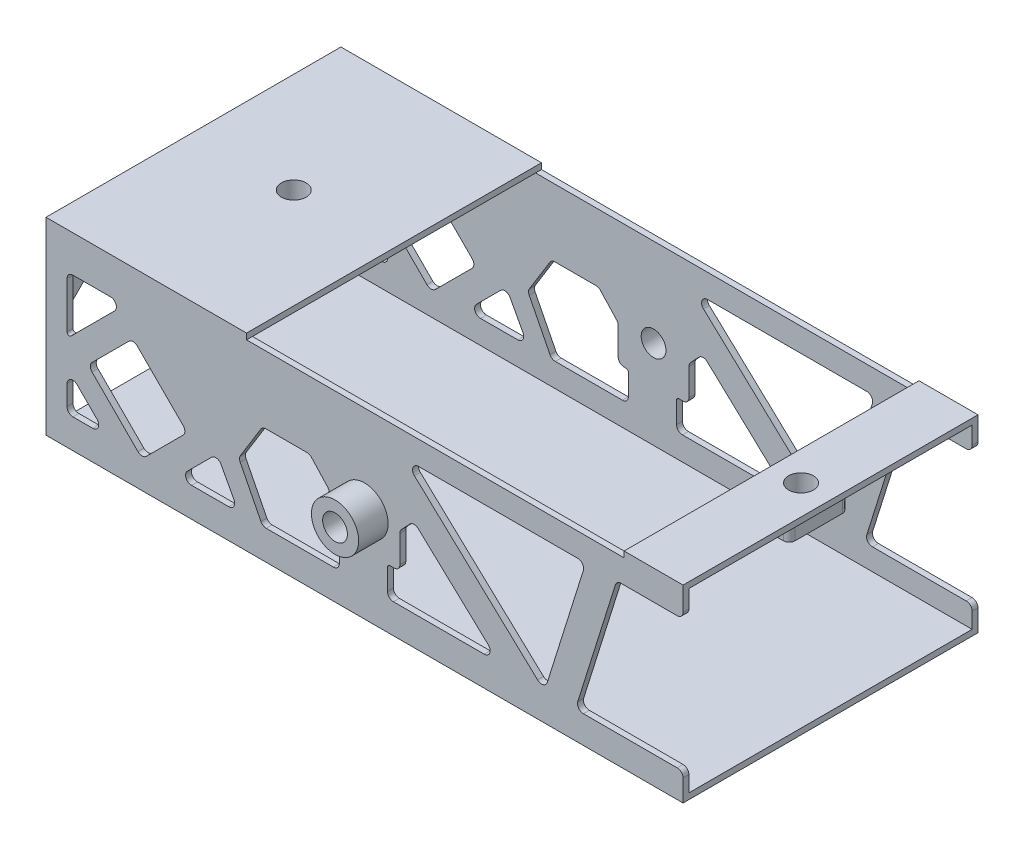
SolidWorks part; units mm, degrees
ref_plane "Front Plane" through (0, 0, 0) normal (0, 0, 1) x (1, 0, 0)
ref_plane "Top Plane" through (0, 0, 0) normal (0, 1, 0) x (1, 0, 0)
ref_plane "Right Plane" through (0, 0, 0) normal (1, 0, 0) x (0, 0, -1)
sketch "Sketch1" plane through (0, 0, 0) normal (0, 1, 0) x (1, 0, 0)
  line L1 (270, -125) -> (-270, -125)
  line L2 (270, -125) -> (270, 125)
  line L3 (270, 125) -> (-270, 125)
  line L4 (-270, -125) -> (-270, 125)
  line L5 (270, -125) -> (-270, 125) construction
  line L6 (270, 125) -> (-270, -125) construction
  point P0 (0, 0)
  dimension "D1" = 250
  dimension "D2" = 540
extrude "Boss-Extrude1" add sketch "Sketch1" along normal blind 5
sketch "Sketch2" plane through (0, 0, 125) normal (0, 0, 1) x (1, 0, 0)
  line L0 (-270, 5) -> (-270, 155)
  line L1 (-270, 155) -> (270, 155)
  line L2 (270, 155) -> (270, 135)
  line L3 (-270, 5) -> (270, 5)
  line L4 (0, 5) -> (0, 69.5) construction
  line L5 (-30, 80) -> (-46.5224, 97.9242)
  line L6 (30, 50) -> (19.4466, 50)
  line L7 (30, 50) -> (30, 80)
  line L9 (-30, 50) -> (-30, 80)
  line L10 (-197.5753, 32.4865) -> (-234.492, 69.4032)
  line L11 (0, 80) -> (-7.4246, 72.5754) construction
  line L12 (-46.5224, 97.9242) -> (-86.4017, 97.9242)
  line L13 (-86.4017, 97.9242) -> (-106.6868, 65.0397)
  line L14 (-106.6868, 65.0397) -> (-86.4017, 25)
  line L15 (-86.4017, 25) -> (-21.4017, 25)
  line L16 (-21.4017, 25) -> (-21.4017, 50)
  line L17 (30, 80) -> (41.793, 92.6127)
  line L18 (41.793, 92.6127) -> (114.1058, 25)
  line L19 (114.1058, 25) -> (19.4466, 25)
  line L20 (19.4466, 25) -> (19.4466, 50)
  line L21 (77.9494, 58.8064) -> (95.0236, 77.0675) construction
  line L22 (95.0236, 77.0675) -> (152.5023, 23.3248)
  line L23 (152.5023, 23.3248) -> (187.5268, 135)
  line L24 (187.5268, 135) -> (33.064, 135)
  line L25 (33.064, 135) -> (95.0236, 77.0675)
  line L26 (270, 155) -> (220, 155) construction
  line L27 (178.703, 23.3248) -> (270, 23.3248)
  line L28 (213.7274, 135) -> (178.703, 23.3248)
  line L29 (270, 155) -> (270, 135)
  line L30 (270, 135) -> (213.7274, 135)
  line L31 (270, 23.3248) -> (270, 5)
  line L32 (-21.4017, 50) -> (-30, 50)
  line L33 (0, 80) -> (0, 155) construction
  line L34 (-234.492, 69.4032) -> (-196.2052, 107.69)
  line L35 (-196.2052, 107.69) -> (-150.2396, 61.7244)
  line L36 (-150.2396, 61.7244) -> (-188.5264, 23.4376)
  line L37 (-188.5264, 23.4376) -> (-197.5753, 32.4865)
  line L38 (-106.6868, 25) -> (-124.8733, 58.8064)
  line L39 (-124.8733, 58.8064) -> (-158.7983, 24.8814)
  line L40 (-158.7983, 24.8814) -> (-106.6868, 25)
  line L41 (-252.1794, 24.8814) -> (-252.1794, 58.8064)
  line L42 (-252.1794, 58.8064) -> (-218.2545, 24.8814)
  line L43 (-218.2545, 24.8814) -> (-252.1794, 24.8814)
  line L44 (-252.1794, 80) -> (-252.1794, 128.9203)
  line L45 (-252.1794, 128.9203) -> (-203.2591, 128.9203)
  line L46 (-203.2591, 128.9203) -> (-252.1794, 80)
  circle A0 centre (0, 80) radius 10.5
  dimension "D1" = 20
  dimension "D2" = 60
  dimension "D3" = 20
  dimension "D4" = 50
  dimension "D5" = 25
  dimension "D6" = 25
  dimension "D7" = 20
  dimension "D8" = 20
  dimension "D9" = 20
extrude "Boss-Extrude2" add sketch "Sketch2" against normal blind 5 contours L31 L27 L28 L30 L2 L1 L0 A0 L40 L39 L38 L32 L16 L15 L14 L13 L12 L5 L9 L25 L24 L23 L22 L19 L20 L6 L7 L17 L18 L36 L37 L10 L34 L35 L42 L43 L41 L45 L46 L44 M16
mirror "Mirror1" about plane through (0, 0, 0) normal (0, 0, 1) of "Boss-Extrude2"
sketch "Sketch3" plane through (-270, 0, 0) normal (-1, 0, 0) x (0, 0, 1)
  line L0 (-120, 155) -> (-45, 155)
  line L1 (120, 155) -> (120, 80)
  line L3 (-120, 80) -> (-120, 155)
  line L4 (-120, 80) -> (-45, 155)
  line L5 (120, 80) -> (45, 155)
  line L6 (45, 155) -> (120, 155)
  dimension "D1" = 75
  dimension "D2" = 75
extrude "Boss-Extrude3" add sketch "Sketch3" against normal blind 5
sketch "Sketch4" plane through (0, 155, 0) normal (0, 1, 0) x (1, 0, 0)
  line L0 (-270, -125) -> (270, -125) construction
  line L1 (-270, 125) -> (-100, 125)
  line L2 (-270, 125) -> (-270, -125)
  line L3 (-270, -125) -> (-100, -125)
  line L4 (-100, 125) -> (-100, -125)
  line L5 (-270, 125) -> (-100, -125) construction
  line L6 (-270, -125) -> (-100, 125) construction
  circle A0 centre (-185, 0) radius 10.5
  point P4 (-185, 0)
extrude "Boss-Extrude4" add sketch "Sketch4" along normal blind 5
sketch "Sketch5" plane through (0, 155, 0) normal (0, 1, 0) x (1, 0, 0)
  line L0 (-100, -125) -> (270, -125) construction
  line L1 (270, 125) -> (220, 125)
  line L2 (270, 125) -> (270, -125)
  line L3 (270, -125) -> (220, -125)
  line L4 (220, 125) -> (220, -125)
  line L5 (270, 125) -> (220, -125) construction
  line L6 (270, -125) -> (220, 125) construction
  circle A0 centre (245, 0) radius 10.5
  point P4 (245, 0)
  dimension "D1" = 50
extrude "Boss-Extrude5" add sketch "Sketch5" along normal blind 5
fillet "Fillet1" radius 5 66 edges at (270, 135, -122.5) (213.7274, 135, -122.5) (270, 135, 122.5) (213.7274, 135, 122.5) (178.703, 23.3248, 122.5) (270, 23.3248, 122.5) (270, 23.3248, -122.5) (178.703, 23.3248, -122.5) (187.5268, 135, -122.5) (152.5023, 23.3248, -122.5) (33.064, 135, -122.5) (114.1058, 25, -122.5) (41.793, 92.6127, -122.5) (30, 80, -122.5) (-30, 50, -122.5) (30, 50, -122.5) (19.4466, 25, -122.5) (-86.4017, 25, -122.5) (-106.6868, 65.0397, -122.5) (-21.4017, 25, -122.5) (-30, 80, -122.5) (-46.5224, 97.9242, -122.5) (-86.4017, 97.9242, -122.5) (-124.8733, 58.8064, -122.5) (-106.6868, 25, -122.5) (-158.7983, 24.8814, -122.5) (-150.2396, 61.7244, -122.5) (-196.2052, 107.69, -122.5) (-234.492, 69.4032, -122.5) (-188.5264, 23.4376, -122.5) (-218.2545, 24.8814, -122.5) (-252.1794, 24.8814, -122.5) (-252.1794, 58.8064, -122.5) (-203.2591, 128.9203, -122.5) (-252.1794, 128.9203, -122.5) (-203.2591, 128.9203, 122.5) (-267.5, 80, 120) (-267.5, 155, 45) (-267.5, 155, -45) (-267.5, 80, -120) (-252.1794, 58.8064, 122.5) (-218.2545, 24.8814, 122.5) (-252.1794, 24.8814, 122.5) (-252.1794, 128.9203, 122.5) (-188.5264, 23.4376, 122.5) (-234.492, 69.4032, 122.5) (-196.2052, 107.69, 122.5) (-150.2396, 61.7244, 122.5) (-106.6868, 25, 122.5) (-158.7983, 24.8814, 122.5) (-124.8733, 58.8064, 122.5) (-21.4017, 25, 122.5) (-86.4017, 25, 122.5) (-106.6868, 65.0397, 122.5) (-86.4017, 97.9242, 122.5) (-46.5224, 97.9242, 122.5) (-30, 80, 122.5) (-30, 50, 122.5) (114.1058, 25, 122.5) (19.4466, 25, 122.5) (30, 50, 122.5) (30, 80, 122.5) (41.793, 92.6127, 122.5) (152.5023, 23.3248, 122.5) (33.064, 135, 122.5) (187.5268, 135, 122.5)
fillet "Fillet2" radius 2 6 edges at (-252.1794, 80, 122.5) (-252.1794, 80, -122.5) (19.4466, 50, -122.5) (-21.4017, 50, -122.5) (-21.4017, 50, 122.5) (19.4466, 50, 122.5)
sketch "Sketch6" plane through (0, 0, -125) normal (0, 0, -1) x (-1, 0, 0)
  circle A0 centre (0, 80) radius 10.5
  circle A1 centre (0, 80) radius 20
extrude "Boss-Extrude6" add sketch "Sketch6" along normal blind 25
mirror "Mirror2" about plane through (0, 0, 0) normal (0, 0, 1) of "Boss-Extrude6"
sketch "Sketch7" plane through (0, 155, 0) normal (0, -1, 0) x (1, 0, 0)
  circle A0 centre (-185, 0) radius 10.5
  circle A1 centre (-185, 0) radius 20
extrude "Boss-Extrude7" add sketch "Sketch7" along normal blind 25
sketch "Sketch8" plane through (0, 160, 0) normal (0, 1, 0) x (1, 0, 0)
  line L1 (-155, -30) -> (-215, -30)
  line L2 (-155, -30) -> (-155, 30)
  line L3 (-155, 30) -> (-215, 30)
  line L4 (-215, -30) -> (-215, 30)
  line L5 (-155, -30) -> (-215, 30) construction
  line L6 (-155, 30) -> (-215, -30) construction
  point P0 (-185, 0)
  dimension "D1" = 60
  dimension "D2" = 60
extrude "Boss-Extrude8" add sketch "Sketch8" against normal blind 10
fillet "Fillet3" radius 5 4 edges at (-155, 152.5, -30) (-155, 152.5, 30) (-215, 152.5, 30) (-215, 152.5, -30)
sketch "Sketch9" plane through (0, 160, 0) normal (0, 1, 0) x (1, 0, 0)
  circle A0 centre (-185, 0) radius 10.5
extrude "Cut-Extrude1" cut sketch "Sketch9" against normal blind 50
sketch "Sketch10" plane through (0, 160, 0) normal (0, 1, 0) x (1, 0, 0)
  line L1 (260, -25) -> (230, -25)
  line L2 (260, -25) -> (260, 25)
  line L3 (260, 25) -> (230, 25)
  line L4 (230, -25) -> (230, 25)
  line L5 (260, -25) -> (230, 25) construction
  line L6 (260, 25) -> (230, -25) construction
  circle A0 centre (245, 0) radius 10.5
  point P0 (245, 0)
  dimension "D1" = 50
  dimension "D2" = 30
extrude "Boss-Extrude9" add sketch "Sketch10" against normal blind 25
fillet "Fillet4" radius 5 4 edges at (230, 145, 25) (230, 145, -25) (260, 145, -25) (260, 145, 25)
